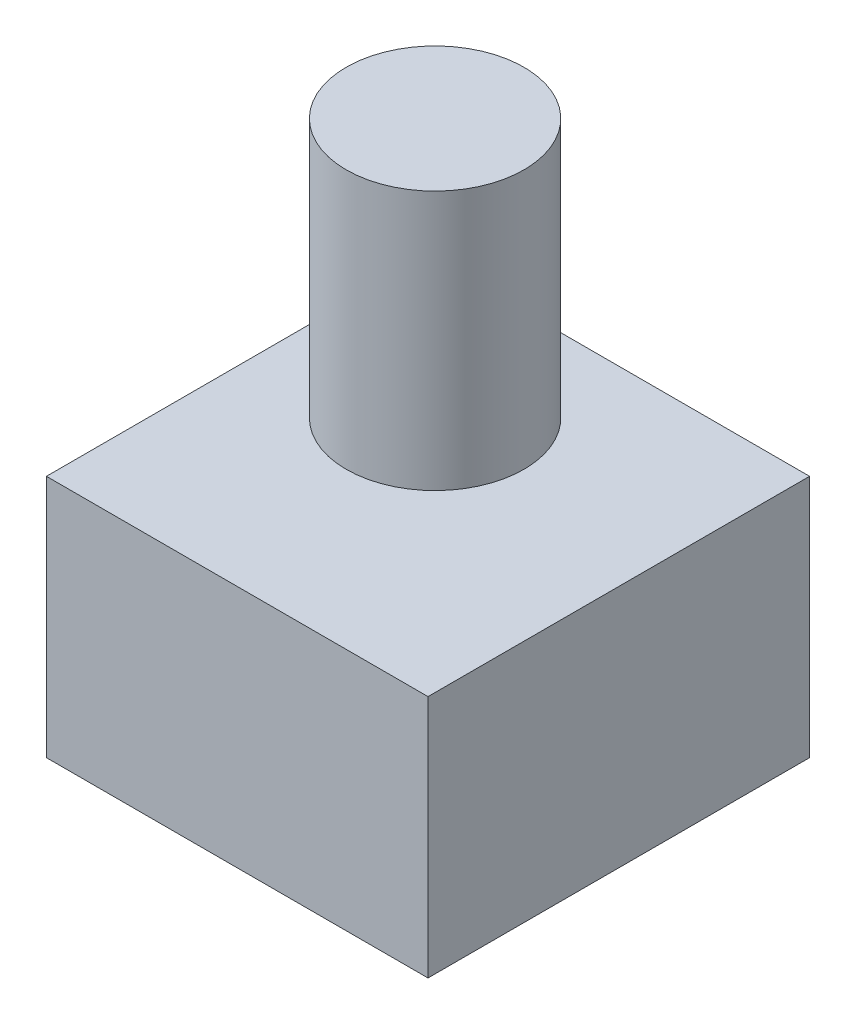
SolidWorks part; units mm, degrees
ref_plane "Front Plane" through (0, 0, 0) normal (0, 0, 1) x (1, 0, 0)
ref_plane "Top Plane" through (0, 0, 0) normal (0, 1, 0) x (1, 0, 0)
ref_plane "Right Plane" through (0, 0, 0) normal (1, 0, 0) x (0, 0, -1)
sketch "Sketch1" plane through (0, 0, 0) normal (0, 1, 0) x (1, 0, 0)
  line L0 (48.7636, -48.7636) -> (-48.7636, 48.7636) construction
  line L1 (-48.7636, 48.7636) -> (48.7636, 48.7636)
  line L2 (-48.7636, 48.7636) -> (-48.7636, -48.7636)
  line L3 (-48.7636, -48.7636) -> (48.7636, -48.7636)
  line L4 (48.7636, 48.7636) -> (48.7636, -48.7636)
extrude "Extrude1" add sketch "Sketch1" along normal blind 62.2905
sketch "Sketch2" plane through (0, 62.2905, 0) normal (0, 1, 0) x (-1, 0, 0)
  circle A0 centre (11.992, -13.8051) radius 22.7234
extrude "Extrude2" add sketch "Sketch2" along normal blind 66.2965
